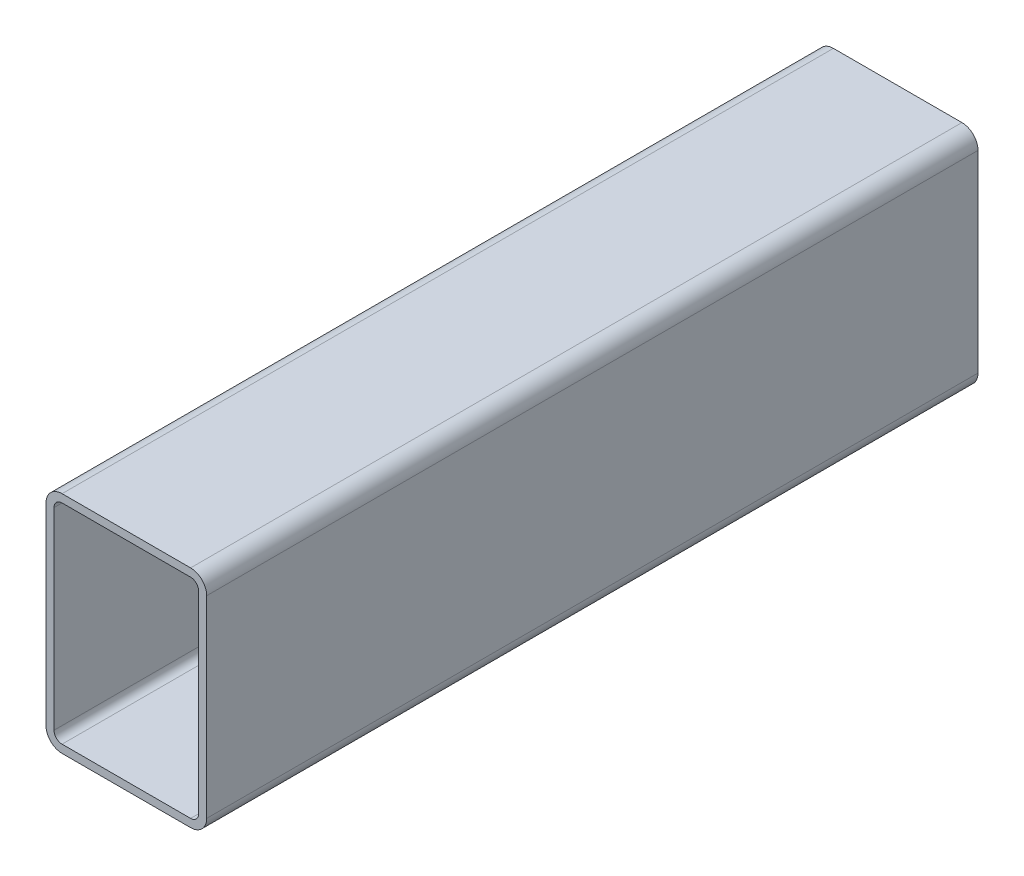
SolidWorks part; units mm, degrees
ref_plane "Front Plane" through (0, 0, 0) normal (0, 0, 1) x (1, 0, 0)
ref_plane "Top Plane" through (0, 0, 0) normal (0, 1, 0) x (1, 0, 0)
ref_plane "Right Plane" through (0, 0, 0) normal (1, 0, 0) x (0, 0, -1)
sketch "Sketch1" plane through (0, 0, 0) normal (0, 0, 1) x (1, 0, 0)
sketch_block_instance "HSS3.5x2.5x0.125-1"
sketch_block "HSS3.5x2.5x0.125"
extrude "Boss-Extrude1" add sketch "Sketch1" along normal blind 304.8
